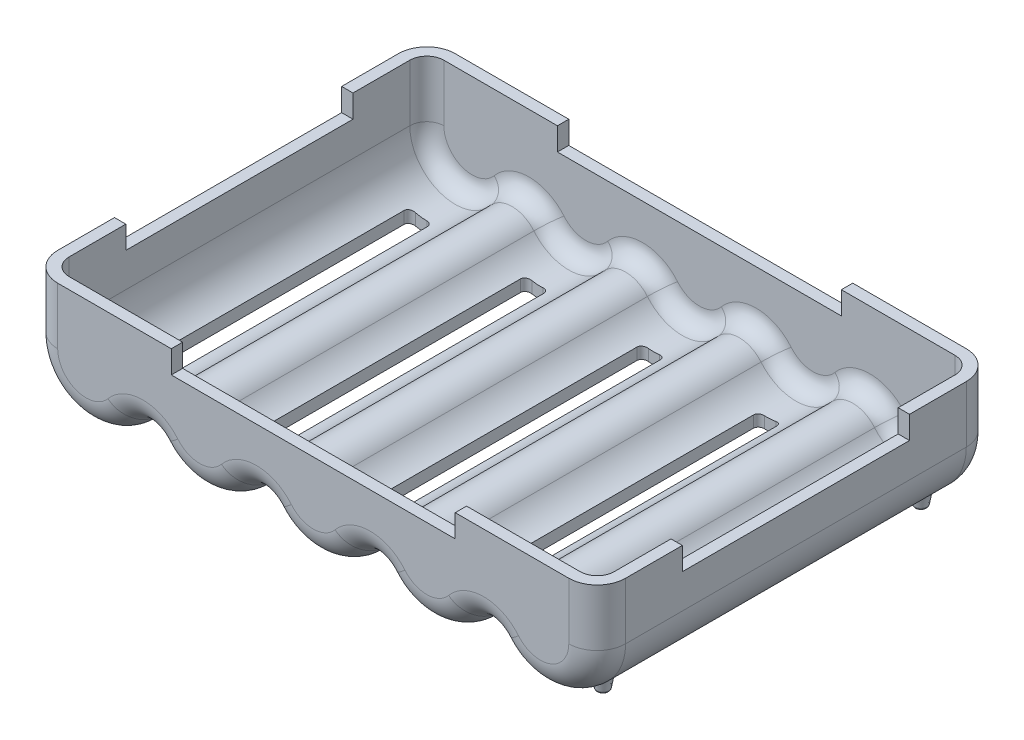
SolidWorks part; units mm, degrees
ref_plane "Front" through (0, 0, 0) normal (0, 0, 1) x (1, 0, 0)
ref_plane "Top" through (0, 0, 0) normal (0, 1, 0) x (1, 0, 0)
ref_plane "Right" through (0, 0, 0) normal (1, 0, 0) x (0, 0, -1)
sketch "Sketch1" plane through (0, 0, 0) normal (0, 0, 1) x (1, 0, 0)
  line L0 (-25, 0) -> (25, 0)
  line L1 (25, 0) -> (25, -5)
  line L2 (-25, 0) -> (-25, -5)
  arc A0 (-25, -5) -> (-16.1538, -8.1949) centre (-20, -5) ccw
  arc A1 (-13.8462, -8.1949) -> (-6.1538, -8.1949) centre (-10, -5) ccw
  arc A2 (-16.1538, -8.1949) -> (-13.8462, -8.1949) centre (-15, -9.1533) cw
  arc A3 (-3.8462, -8.1949) -> (3.8462, -8.1949) centre (0, -5) ccw
  arc A4 (6.1538, -8.1949) -> (13.8462, -8.1949) centre (10, -5) ccw
  arc A5 (25, -5) -> (16.1538, -8.1949) centre (20, -5) cw
  arc A6 (16.1538, -8.1949) -> (13.8462, -8.1949) centre (15, -9.1533) ccw
  arc A7 (-6.1538, -8.1949) -> (-3.8462, -8.1949) centre (-5, -9.1533) cw
  arc A8 (3.8462, -8.1949) -> (6.1538, -8.1949) centre (5, -9.1533) cw
  dimension "D2" = 5
  dimension "D5" = 1.5
  dimension "D1" = 50
  dimension "D3" = 5
extrude "Boss-Extrude1" add sketch "Sketch1" along normal mid plane 35
fillet "Fillet1" radius 2.5 22 edges at (-25, -2.5, -17.5) (25, -2.5, -17.5) (21.6984, -9.7027, -17.5) (15, -7.6533, -17.5) (10, -10, -17.5) (5, -7.6533, -17.5) (0, -10, -17.5) (-5, -7.6533, -17.5) (-10, -10, -17.5) (-15, -7.6533, -17.5) (-25, -2.5, 17.5) (25, -2.5, 17.5) (21.6984, -9.7027, 17.5) (15, -7.6533, 17.5) (10, -10, 17.5) (5, -7.6533, 17.5) (0, -10, 17.5) (-5, -7.6533, 17.5) (-10, -10, 17.5) (-15, -7.6533, 17.5) (-21.6984, -9.7027, -17.5) (-21.6984, -9.7027, 17.5)
shell "Shell1" thickness 1
sketch "Sketch2" plane through (0, 0, 17.5) normal (0, 0, 1) x (1, 0, 0)
  line L0 (22.5, 0) -> (-22.5, 0) construction
  line L1 (-12.5, 0) -> (12.5, 0)
  line L2 (-12.5, 0) -> (-12.5, -2)
  line L3 (-12.5, -2) -> (12.5, -2)
  line L4 (12.5, 0) -> (12.5, -2)
  dimension "D1" = 25
  dimension "D3" = 2
extrude "Cut-Extrude1" cut sketch "Sketch2" against normal through all
sketch "Sketch4" plane through (25, 0, 0) normal (1, 0, 0) x (0, 0, -1)
  line L1 (-10, 0) -> (10, 0)
  line L2 (-10, 0) -> (-10, -2)
  line L3 (-10, -2) -> (10, -2)
  line L4 (10, 0) -> (10, -2)
  line L5 (-15, 0) -> (15, 0) construction
  dimension "D1" = 20
  dimension "D2" = 10
  dimension "D3" = 2
extrude "Cut-Extrude3" cut sketch "Sketch4" against normal through all
sketch "Sketch5" plane through (0, 0, 0) normal (0, 1, 0) x (1, 0, 0)
  line L0 (-32.0839, 0) -> (32.0839, 0) construction
  line L1 (-21, 12.5) -> (-20, 12.5)
  line L2 (-21.5, 12) -> (-21.5, -12)
  line L3 (-21, -12.5) -> (-20, -12.5)
  line L4 (-19.5, 12) -> (-19.5, -12)
  line L5 (0, 25.3905) -> (0, -21.7396) construction
  line L6 (-12.5, 17.5) -> (-22.5, 17.5) construction
  arc A0 (-21.5, -12) -> (-21, -12.5) centre (-21, -12) ccw
  arc A1 (-19.5, -12) -> (-20, -12.5) centre (-20, -12) cw
  arc A2 (-21, 12.5) -> (-21.5, 12) centre (-21, 12) ccw
  arc A3 (-20, 12.5) -> (-19.5, 12) centre (-20, 12) cw
  point P14 (-21.5, -12.5)
  point P17 (-19.5, -12.5)
  point P20 (-21.5, 12.5)
  dimension "D5" = 0.5
  dimension "D1" = 25
  dimension "D2" = 5
  dimension "D3" = 2
  dimension "D4" = 3.5
extrude "Cut-Extrude4" cut sketch "Sketch5" against normal blind 35
pattern_linear "LPattern1" count 5 spacing 10.25 along (1, 0, 0) of "Cut-Extrude4"
ref_plane "Plane1" through (0, -10.5, 0) normal (0, 1, 0) x (1, 0, 0)
sketch "Sketch6" plane through (0, -10.5, 0) normal (0, 1, 0) x (1, 0, 0)
  circle A0 centre (-22, 14) radius 0.5
  dimension "D1" = 1
  dimension "D2" = 22
  dimension "D3" = 14
extrude "Boss-Extrude3" add sketch "Sketch6" along normal up to next draft 10
ref_plane "Plane2" through (0, 0, 0) normal (0, 0, -1) x (-1, 0, 0)
fillet "Fillet4" radius 0.25 1 edges at (-22, -10.5, -13.5)
pattern_linear "LPattern4" count 2 spacing 28 along (0, 0, 1) count 2 spacing 44 along (1, 0, 0) of "Boss-Extrude3", "Fillet4"
